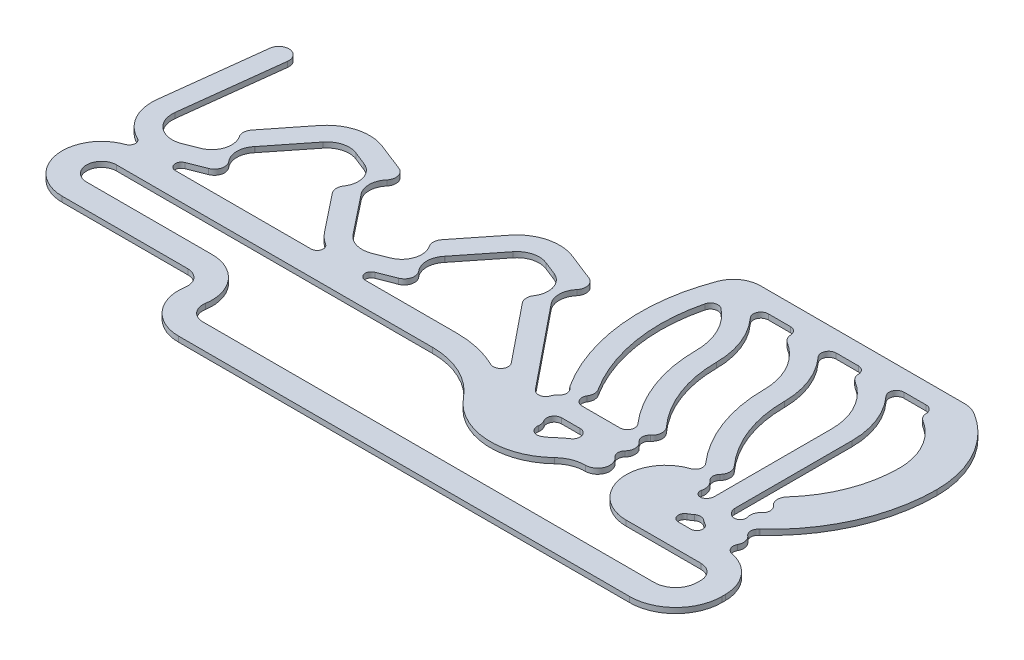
SolidWorks part; units mm, degrees
other "<6021_lower_plate>-<Fillet8>"
ref_plane "X_Y" through (0, 0, 0) normal (0, 0, 1) x (1, 0, 0)
ref_plane "Z_X" through (0, 0, 0) normal (0, 1, 0) x (1, 0, 0)
ref_plane "Y_Z" through (0, 0, 0) normal (1, 0, 0) x (0, 0, -1)
ref_plane "X_Y-6021_lower_plate" through (0, 0, 0) normal (0, 0, 1) x (1, 0, 0)
ref_plane "Z_X-6021_lower_plate" through (0, 0, 0) normal (0, 1, 0) x (1, 0, 0)
ref_plane "Y_Z-6021_lower_plate" through (0, 0, 0) normal (1, 0, 0) x (0, 0, -1)
ref_plane "X_Y-_6021_master-6021_lower_plate" through (0, 0, 0) normal (0, 0, 1) x (1, 0, 0)
ref_plane "Z_X_peltier-_6021_master-6021_lower_plate" through (0, 0, 0) normal (0, 1, 0) x (1, 0, 0)
ref_plane "Y_Z-_6021_master-6021_lower_plate" through (0, 0, 0) normal (1, 0, 0) x (0, 0, -1)
sketch "zx_sketch-_6021_master-6021_lower_plate" plane through (0, 0, 0) normal (0, 1, 0) x (1, 0, 0)
  line L0 (0, 0) -> (0, 39833.2138) construction
  line L1 (-56.5, 24.66) -> (4, 24.66)
  line L2 (-56.5, 24.66) -> (-56.5, -27)
  line L3 (-56.5, -27) -> (56.5, -27)
  line L4 (56.5, 27) -> (56.5, -27)
  line L5 (0, 0) -> (39833.2138, 0) construction
  line L6 (4, 24.66) -> (4, 27)
  line L11 (4, 27) -> (56.5, 27)
  point P3 (0, -27)
  point P17 (-22.5, 15.66)
  point P18 (22.5, 15.66)
  point P19 (22.5, -15.66)
  point P20 (-22.5, -15.66)
  dimension "D1" = 113
  dimension "D2" = 24.66
  dimension "D3" = 45
  dimension "D4" = 31.32
  dimension "D5" = 27
  dimension "D6" = 2.34
  dimension "D7" = 4
  dimension "D8" = 27
sketch "xy_sketch-_6021_master-6021_lower_plate" plane through (0, 0, 0) normal (0, 0, 1) x (1, 0, 0)
  line L0 (0, 0) -> (0, 5) construction
  line L1 (0, 5) -> (0, 7.3) construction
  dimension "D1" = 5
  dimension "D2" = 2.3
ref_plane "zx_lower_plate-_6021_master-6021_lower_plate" through (0, 5, 0) normal (0, 1, 0) x (1, 0, 0)
ref_plane "zx_sensor-_6021_master-6021_lower_plate" through (0, 7.3, 0) normal (0, 1, 0) x (1, 0, 0)
sketch "zx_sensor_sketch-_6021_master-6021_lower_plate" plane through (0, 7.3, 0) normal (0, 1, 0) x (1, 0, 0)
  line L0 (-42.2, 3.16) -> (-28.2, 8.66) construction
  line L1 (-28.2, 8.66) -> (-14.2, 3.16) construction
  line L2 (-14.2, 3.16) -> (-0.2, 8.66) construction
  line L3 (-42.2, 4.96) -> (-42.2, -0.8) construction
  line L4 (-28.2, 10.46) -> (-28.2, 4.7) construction
  line L5 (-14.2, 4.96) -> (-14.2, -0.8) construction
  line L6 (-0.2, 10.46) -> (-0.2, 4.7) construction
  line L7 (-42.2, 3.16) -> (-42.2, -0.8) construction
  line L8 (-28.2, 8.66) -> (-28.2, 4.7) construction
  line L9 (-14.2, 3.16) -> (-14.2, -0.8) construction
  line L10 (-0.2, 8.66) -> (-0.2, 4.7) construction
  line L11 (-39.215, 3.16) -> (-45.185, 3.16) construction
  line L12 (-39.215, 7.475) -> (-39.215, -1.155) construction
  line L13 (-44.615, 3.16) -> (-39.785, 3.16) construction
  point P8 (-42.2, 2.08)
  point P16 (-42.2, 3.16)
  point P19 (-39.215, 3.16)
  point P22 (-42.2, 3.16)
  dimension "D3" = 14
  dimension "D4" = 1.08
  dimension "D6" = 5.76
  dimension "D7" = 5.97
  dimension "D9" = 8.63
  dimension "D10" = 4.83
  dimension "D11" = 5.5
sketch "zx_valve_sketch-_6021_master-6021_lower_plate" plane through (0, 8.2, 0) normal (0, 1, 0) x (1, 0, 0)
  line L0 (44, -4.25) -> (34, -4.25) construction
  line L1 (34, -4.25) -> (24, -4.25) construction
  line L2 (24, -4.25) -> (14, -4.25) construction
  line L3 (44, -10.5) -> (44, -6.5) construction
  line L4 (44, -6.5) -> (44, -2.5) construction
  line L5 (34, -2.5) -> (34, -6.5) construction
  line L6 (34, -6.5) -> (34, -10.5) construction
  line L7 (24, -2.5) -> (24, -6.5) construction
  line L8 (24, -6.5) -> (24, -10.5) construction
  line L9 (14, -2.5) -> (14, -6.5) construction
  line L10 (14, -6.5) -> (14, -10.5) construction
  line L11 (44, 10.5) -> (44, -19) construction
  line L12 (34, 10.5) -> (34, -19) construction
  line L14 (24, -19) -> (24, 10.5) construction
  line L17 (14, 10.5) -> (14, -19) construction
  point P20 (44, -4.25)
  dimension "D1" = 10
  dimension "D4" = 8
  dimension "D5" = 2.25
  dimension "D6" = 29.5
sketch "zx_manifold_sketch-_6021_master-6021_lower_plate" plane through (0, 5, 0) normal (0, 1, 0) x (1, 0, 0)
  line L0 (-34.0003, 7.58) -> (-22.3997, 7.58) construction
  line L4 (44, 19.5) -> (34, 19.5) construction
  line L5 (34, 19.5) -> (24, 19.5) construction
  line L6 (24, 19.5) -> (14, 19.5) construction
  line L7 (39, 10.5) -> (39, -7.6132)
  line L9 (-48.0003, 2.08) -> (-36.3997, 2.08) construction
  line L11 (-20.0003, 2.08) -> (-8.3997, 2.08) construction
  line L12 (-6.0003, 7.58) -> (5.6003, 7.58) construction
  line L13 (-48.9, -6.72) -> (-2.2958, -6.72)
  line L15 (14, -6.5) -> (24, -6.5)
  line L17 (-14.2, 4.96) -> (-9.7626, 10.5608)
  line L22 (34, -4.7265) -> (44, -4.7265) construction
  line L23 (44, -4.7265) -> (39, -7.6132) construction
  line L24 (-4.2467, 12.0482) -> (-0.2, 10.46)
  line L26 (44, 22) -> (14, 22)
  line L28 (-48.9, -14.72) -> (-30.3969, -14.72)
  line L30 (10.8896, -9.015) -> (7.7791, -11.53) construction
  line L31 (34, -14.5) -> (45, -14.5)
  line L32 (-22.5, -24) -> (44, -24)
  line L35 (-14.2, -0.8) -> (-18.2467, -2.3882)
  line L38 (-52.7667, 2.6469) -> (-51, 17.5)
  line L39 (-28.2, 4.7) -> (-23.7626, -0.9008)
  line L40 (14, 10.5) -> (22.5, 15.66) construction
  line L43 (49, -19) -> (49, -18.5)
  line L45 (-32.2467, 12.0482) -> (-28.2, 10.46)
  line L46 (-37.7626, 10.5608) -> (-42.2, 4.96)
  line L47 (-42.2, -0.8) -> (-46.2467, -2.3882)
  line L48 (-0.2, 4.7) -> (10.8896, -9.015)
  circle A0 centre (34, 19.5) radius 3.85 construction
  circle A1 centre (44, 19.5) radius 3.85 construction
  circle A2 centre (24, 19.5) radius 3.85 construction
  circle A3 centre (14, 19.5) radius 3.85 construction
  arc A4 (34, -10.5) -> (39, -7.6132) centre (34, -4.7265) ccw
  arc A6 (29, 10.5) -> (34, -2.5) centre (48.4, 10.5) ccw
  arc A7 (44, -10.5) -> (39, -7.6132) centre (44, -4.7265) cw
  arc A8 (44, -2.5) -> (49, 10.5) centre (29.6, 10.5) ccw
  arc A11 (45.3208, 21.6226) -> (44, 22) centre (44, 19.5) ccw
  arc A12 (44, -6.5) -> (51.5, 10.5) centre (28.4833, 10.5) ccw
  arc A13 (14, 22) -> (11.6636, 20.3896) centre (14, 19.5) ccw
  arc A15 (34, -14.5) -> (34, -6.5) centre (34, -10.5) cw
  arc A16 (-48.9, -6.72) -> (-48.9, -14.72) centre (-48.9, -10.72) ccw
  arc A17 (44, -24) -> (49, -19) centre (44, -19) ccw
  arc A18 (-22.5, -24) -> (-26.4485, -19.36) centre (-22.5, -20) cw
  arc A19 (-30.3969, -14.72) -> (-26.4485, -19.36) centre (-30.3969, -18.72) cw
  arc A20 (14, -10.5) -> (10.8896, -9.015) centre (14, -6.5) cw
  arc A21 (-4.2467, 12.0482) -> (-9.7626, 10.5608) centre (-6.0003, 7.58) ccw
  circle A22 centre (-51, 17.5) radius 3.85 construction
  arc A23 (-23.7626, -0.9008) -> (-18.2467, -2.3882) centre (-20.0003, 2.08) ccw
  arc A24 (-32.2467, 12.0482) -> (-37.7626, 10.5608) centre (-34.0003, 7.58) ccw
  arc A25 (-46.2467, -2.3882) -> (-52.7667, 2.6469) centre (-48.0003, 2.08) cw
  arc A26 (49, -18.5) -> (45, -14.5) centre (45, -18.5) ccw
  circle A27 centre (-51, 17.5) radius 5.5 construction
  arc A29 (14, 19.5) -> (19, 10.5) centre (8.4, 10.5) cw
  arc A30 (39, 10.5) -> (34, 19.5) centre (28.4, 10.5) ccw
  arc A31 (49, 10.5) -> (44, 19.5) centre (38.4, 10.5) ccw
  arc A32 (29, 10.5) -> (24, 19.5) centre (18.4, 10.5) ccw
  arc A33 (19, 10.5) -> (24, -2.5) centre (38.4, 10.5) ccw
  arc A35 (45.3208, 21.6226) -> (51.5, 10.5) centre (38.4, 10.5) cw
  arc A36 (14, -2.5) -> (11.6636, 20.3896) centre (35.6147, 11.2703) cw
  arc A37 (19.5172, -12.2931) -> (7.7791, -11.53) centre (14, -6.5) cw
  arc A38 (7.7791, -11.53) -> (-2.2958, -6.72) centre (-2.2958, -19.6763) ccw
  arc A39 (24, -10.5) -> (19.5172, -12.2931) centre (24, -17) ccw
  point P73 (0, 0)
  point P75 (0, 0)
  point P107 (0, 0)
  point P121 (-42.2, 2.08)
  dimension "D1" = 30
  dimension "D2" = 7.7
  dimension "D4" = 2.5
  dimension "D5" = 4
  dimension "D6" = 92.9
  dimension "D9" = 4
  dimension "D15" = 4
  dimension "D18" = 4.8
  dimension "D11" = 4
sketch "zx_screws_sketch-_6021_master-6021_lower_plate" plane through (0, 5, 0) normal (0, 1, 0) x (1, 0, 0)
  line L4 (-34.0003, 7.58) -> (-22.3997, 7.58) construction
  line L5 (-20.0003, 2.08) -> (-8.3997, 2.08) construction
  line L6 (-6.0003, 7.58) -> (5.6003, 7.58) construction
  line L7 (-36.3997, 2.08) -> (-48.0003, 2.08) construction
  line L13 (56.5, 27) -> (56.5, -27) construction
  circle A0 centre (52.5, 23) radius 4 construction
  circle A3 centre (52.5, -23) radius 4 construction
  arc A7 (-52.7667, 2.6469) -> (-46.2467, -2.3882) centre (-48.0003, 2.08) ccw construction
  circle A8 centre (-52.5, -23) radius 4 construction
  point P0 (-0.2, -19)
  point P1 (52.5, -23)
  point P2 (52.5, 23)
  point P3 (6.6, 23)
  point P4 (-52.5, -23)
  point P5 (-42.2, 17.5)
ref_plane "yz_sensor-_6021_master-6021_lower_plate" through (-42.2, 0, 0) normal (1, 0, 0) x (0, 0, -1)
ref_plane "zx_valve-_6021_master-6021_lower_plate" through (0, 8.2, 0) normal (0, 1, 0) x (1, 0, 0)
ref_plane "zx_sensor_shelf-_6021_master-6021_lower_plate" through (0, 9.691, 0) normal (0, 1, 0) x (1, 0, 0)
sketch "Sketch7-6021_lower_plate" plane through (0, 5, 0) normal (0, 1, 0) x (1, 0, 0)
  line L6 (-56.5, -27) -> (56.5, -27)
  line L7 (56.5, 27) -> (56.5, -27)
  line L8 (4, 27) -> (56.5, 27)
  line L9 (4, 24.66) -> (4, 27)
  line L10 (-56.5, 24.66) -> (4, 24.66)
  line L11 (-56.5, 24.66) -> (-56.5, -27)
sketch "Sketch33-6021_lower_plate" plane through (0, 5, 0) normal (0, 1, 0) x (1, 0, 0)
  line L6 (-50.6814, 2.3989) -> (-48.9147, 17.252)
  line L7 (-42.9672, 1.1548) -> (-47.0139, -0.4334)
  line L10 (-54.852, 2.895) -> (-53.0853, 17.748)
  line L11 (-41.4328, -2.7548) -> (-45.4795, -4.343)
  line L15 (44, 24.1) -> (14, 24.1)
  line L19 (44, 19.9) -> (14, 19.9)
  line L23 (-40.554, 3.6559) -> (-36.1166, 9.2567)
  line L24 (-33.0139, 10.0934) -> (-28.9672, 8.5052)
  line L27 (-43.846, 6.2641) -> (-39.4086, 11.8649)
  line L28 (-31.4795, 14.003) -> (-27.4328, 12.4148)
  line L33 (-17.4795, -4.343) -> (-13.4328, -2.7548)
  line L34 (-29.846, 3.3959) -> (-25.4086, -2.2049)
  line L37 (-19.0139, -0.4334) -> (-14.9672, 1.1548)
  line L38 (-26.554, 6.0041) -> (-22.1166, 0.4033)
  line L40 (-1.833, 3.3796) -> (9.2566, -10.3354)
  line L43 (-5.0139, 10.0934) -> (-0.9672, 8.5052)
  line L44 (-12.554, 3.6559) -> (-8.1166, 9.2567)
  line L47 (-3.4795, 14.003) -> (0.5672, 12.4148)
  line L48 (-15.846, 6.2641) -> (-11.4086, 11.8649)
  line L50 (1.433, 6.0204) -> (12.5225, -7.6946)
  arc A0 (-53.0853, 17.748) -> (-48.9147, 17.252) centre (-51, 17.5) cw
  arc A1 (-42.9672, 1.1548) -> (-41.4328, -2.7548) centre (-42.2, -0.8) cw
  arc A3 (-50.6814, 2.3989) -> (-47.0139, -0.4334) centre (-48.0003, 2.08) ccw
  arc A5 (-54.852, 2.895) -> (-45.4795, -4.343) centre (-48.0003, 2.08) ccw
  arc A9 (-1.833, 3.3796) -> (1.433, 6.0204) centre (-0.2, 4.7) cw
  arc A14 (-33.0139, 10.0934) -> (-36.1166, 9.2567) centre (-34.0003, 7.58) ccw
  arc A16 (-31.4795, 14.003) -> (-39.4086, 11.8649) centre (-34.0003, 7.58) ccw
  arc A32 (12.2289, -3.6283) -> (15.7711, -1.3717) centre (14, -2.5) ccw
  arc A33 (14, -8.4) -> (14, -12.6) centre (14, -10.5) cw
  arc A34 (42.5843, -4.949) -> (45.4157, -8.051) centre (44, -6.5) ccw
  arc A43 (-25.4086, -2.2049) -> (-17.4795, -4.343) centre (-20.0003, 2.08) ccw
  arc A45 (-22.1166, 0.4033) -> (-19.0139, -0.4334) centre (-20.0003, 2.08) ccw
  arc A48 (-5.0139, 10.0934) -> (-8.1166, 9.2567) centre (-6.0003, 7.58) ccw
  arc A50 (-3.4795, 14.003) -> (-11.4086, 11.8649) centre (-6.0003, 7.58) ccw
  arc A51 (-43.846, 6.2641) -> (-40.554, 3.6559) centre (-42.2, 4.96) ccw
  arc A56 (-28.9672, 8.5052) -> (-27.4328, 12.4148) centre (-28.2, 10.46) ccw
  arc A57 (-29.846, 3.3959) -> (-26.554, 6.0041) centre (-28.2, 4.7) cw
  arc A58 (-15.846, 6.2641) -> (-12.554, 3.6559) centre (-14.2, 4.96) ccw
  arc A59 (-14.9672, 1.1548) -> (-13.4328, -2.7548) centre (-14.2, -0.8) cw
  arc A60 (0.5672, 12.4148) -> (-0.9672, 8.5052) centre (-0.2, 10.46) cw
  arc A67 (9.7011, 21.1368) -> (12.2289, -3.6283) centre (35.6147, 11.2703) ccw
  arc A69 (9.2566, -10.3354) -> (14, -12.6) centre (14, -6.5) ccw
  arc A71 (12.5225, -7.6946) -> (14, -8.4) centre (14, -6.5) ccw
  arc A72 (14, 24.1) -> (9.7011, 21.1368) centre (14, 19.5) ccw
  arc A73 (46.4302, 23.4057) -> (44, 24.1) centre (44, 19.5) ccw
  arc A74 (53.6, 10.5) -> (46.4302, 23.4057) centre (38.4, 10.5) ccw
  arc A75 (45.4157, -8.051) -> (53.6, 10.5) centre (28.4833, 10.5) ccw
  arc A81 (13.6262, 19.6423) -> (15.7711, -1.3717) centre (35.6147, 11.2703) ccw
  arc A82 (14, 19.9) -> (13.6262, 19.6423) centre (14, 19.5) ccw
  arc A83 (44.2113, 19.8396) -> (44, 19.9) centre (44, 19.5) ccw
  arc A84 (49.4, 10.5) -> (44.2113, 19.8396) centre (38.4, 10.5) ccw
  arc A85 (42.5843, -4.949) -> (49.4, 10.5) centre (28.4833, 10.5) ccw
sketch "Sketch34-6021_lower_plate" plane through (0, 5, 0) normal (0, 1, 0) x (1, 0, 0)
  line L5 (41.1, -6.9814) -> (41.1, 10.5)
  line L7 (36.9, -6.9814) -> (36.9, 10.5)
  line L10 (14, -8.6) -> (24, -8.6)
  line L12 (14, -4.4) -> (24, -4.4)
  arc A5 (14, -4.4) -> (14, -8.6) centre (14, -6.5) ccw
  arc A11 (31.1, 10.5) -> (35.5588, -1.0928) centre (48.4, 10.5) ccw
  arc A12 (31.1, 10.5) -> (25.1094, 21.283) centre (18.4, 10.5) ccw
  arc A15 (26.9, 10.5) -> (32.4412, -3.9072) centre (48.4, 10.5) ccw
  arc A16 (26.9, 10.5) -> (22.8906, 17.717) centre (18.4, 10.5) ccw
  arc A18 (41.1, -6.9814) -> (44, -8.4) centre (44, -4.7265) ccw
  arc A19 (41.1, 10.5) -> (35.1094, 21.283) centre (28.4, 10.5) ccw
  arc A22 (39, -10.8086) -> (44, -12.6) centre (44, -4.7265) ccw
  arc A23 (36.9, 10.5) -> (32.8906, 17.717) centre (28.4, 10.5) ccw
  arc A25 (34, -12.6) -> (39, -10.8086) centre (34, -4.7265) ccw
  arc A27 (34, -8.4) -> (36.9, -6.9814) centre (34, -4.7265) ccw
  arc A28 (24, -4.4) -> (24, -8.6) centre (24, -6.5) cw
  arc A29 (35.5588, -1.0928) -> (32.4412, -3.9072) centre (34, -2.5) cw
  arc A30 (34, -8.4) -> (34, -12.6) centre (34, -10.5) ccw
  arc A31 (44, -8.4) -> (44, -12.6) centre (44, -10.5) cw
  arc A32 (22.8906, 17.717) -> (25.1094, 21.283) centre (24, 19.5) cw
  arc A33 (35.1094, 21.283) -> (32.8906, 17.717) centre (34, 19.5) ccw
  arc A36 (42.8906, 17.717) -> (45.1094, 21.283) centre (44, 19.5) cw
  arc A37 (45.5588, -3.9072) -> (42.4412, -1.0928) centre (44, -2.5) cw
  arc A40 (51.1, 10.5) -> (45.1094, 21.283) centre (38.4, 10.5) ccw
  arc A41 (45.5588, -3.9072) -> (51.1, 10.5) centre (29.6, 10.5) ccw
  arc A44 (46.9, 10.5) -> (42.8906, 17.717) centre (38.4, 10.5) ccw
  arc A45 (42.4412, -1.0928) -> (46.9, 10.5) centre (29.6, 10.5) ccw
sketch "Sketch35-6021_lower_plate" plane through (0, 5, 0) normal (0, 1, 0) x (1, 0, 0)
  line L45 (34, -16.9) -> (45, -16.9)
  line L46 (46.6, -18.5) -> (46.6, -19)
  line L47 (44, -21.6) -> (-22.5, -21.6)
  line L48 (-30.3969, -12.32) -> (-48.9, -12.32)
  line L49 (-48.9, -9.12) -> (-2.2958, -9.12)
  line L55 (34, -12.1) -> (45, -12.1)
  line L56 (51.4, -18.5) -> (51.4, -19)
  line L57 (44, -26.4) -> (-22.5, -26.4)
  line L58 (-30.3969, -17.12) -> (-48.9, -17.12)
  line L59 (-48.9, -4.32) -> (-2.2958, -4.32)
  arc A8 (12.8906, 17.717) -> (15.1094, 21.283) centre (14, 19.5) cw
  arc A9 (21.1, 10.5) -> (25.5588, -1.0928) centre (38.4, 10.5) ccw
  arc A11 (21.1, 10.5) -> (15.1094, 21.283) centre (8.4, 10.5) ccw
  arc A13 (22.4412, -3.9072) -> (25.5588, -1.0928) centre (24, -2.5) ccw
  arc A50 (16.9, 10.5) -> (22.4412, -3.9072) centre (38.4, 10.5) ccw
  arc A51 (16.9, 10.5) -> (12.8906, 17.717) centre (8.4, 10.5) ccw
  arc A69 (24, -8.1) -> (24, -12.9) centre (24, -10.5) cw
  arc A70 (34, -4.1) -> (34, -8.9) centre (34, -6.5) cw
  arc A71 (17.8621, -10.5552) -> (24, -8.1) centre (24, -17) cw
  arc A72 (21.1724, -14.031) -> (24, -12.9) centre (24, -17) cw
  arc A87 (34, -4.1) -> (34, -16.9) centre (34, -10.5) ccw
  arc A88 (46.6, -18.5) -> (45, -16.9) centre (45, -18.5) ccw
  arc A89 (44, -21.6) -> (46.6, -19) centre (44, -19) ccw
  arc A90 (-24.0794, -19.744) -> (-22.5, -21.6) centre (-22.5, -20) ccw
  arc A91 (-24.0794, -19.744) -> (-30.3969, -12.32) centre (-30.3969, -18.72) ccw
  arc A92 (-48.9, -9.12) -> (-48.9, -12.32) centre (-48.9, -10.72) ccw
  arc A93 (5.9129, -13.039) -> (-2.2958, -9.12) centre (-2.2958, -19.6763) ccw
  arc A94 (5.9129, -13.039) -> (21.1724, -14.031) centre (14, -6.5) ccw
  arc A119 (34, -8.9) -> (34, -12.1) centre (34, -10.5) ccw
  arc A120 (51.4, -18.5) -> (45, -12.1) centre (45, -18.5) ccw
  arc A121 (44, -26.4) -> (51.4, -19) centre (44, -19) ccw
  arc A122 (-28.8175, -18.976) -> (-22.5, -26.4) centre (-22.5, -20) ccw
  arc A123 (-28.8175, -18.976) -> (-30.3969, -17.12) centre (-30.3969, -18.72) ccw
  arc A124 (-48.9, -4.32) -> (-48.9, -17.12) centre (-48.9, -10.72) ccw
  arc A125 (9.6454, -10.021) -> (-2.2958, -4.32) centre (-2.2958, -19.6763) ccw
  arc A126 (9.6454, -10.021) -> (17.8621, -10.5552) centre (14, -6.5) ccw
  point P8 (22.3624, -8.3387)
  point P10 (0, 0)
sketch "Sketch36-6021_lower_plate" plane through (0, 5, 0) normal (0, 1, 0) x (1, 0, 0)
  line L1 (-42.9672, 1.1548) -> (-45.0438, 0.3399)
  line L3 (-31.0261, 9.3132) -> (-28.9672, 8.5052)
  arc A0 (-43.9508, 3.8004) -> (-45.0438, 0.3399) centre (-45.8963, 2.512) cw
  arc A2 (-40.6034, 3.5958) -> (-40.6034, 0.5642) centre (-38.8294, 2.08) ccw
  arc A5 (-40.6034, 0.5642) -> (-42.9672, 1.1548) centre (-42.2, -0.8) ccw
  arc A6 (-43.9508, 3.8004) -> (-40.6034, 3.5958) centre (-42.2, 4.96) ccw
  arc A9 (-26.6075, 6.0689) -> (-29.9458, 5.8671) centre (-28.2, 4.7) ccw
  arc A10 (-28.9672, 8.5052) -> (-26.6075, 9.0911) centre (-28.2, 10.46) ccw
  arc A11 (-26.6075, 9.0911) -> (-26.6075, 6.0689) centre (-24.8496, 7.58) ccw
  arc A12 (-31.0261, 9.3132) -> (-29.9458, 5.8671) centre (-31.873, 7.1554) cw
  dimension "D1" = 2.4
  dimension "D2" = 2.4
sketch "xz_cover-_6021_master-6021_lower_plate" plane through (0, 0, 0) normal (0, 1, 0) x (1, 0, 0)
  line L1 (-63, -36.79) -> (63, -36.79)
  line L2 (-71.85, -27.94) -> (-71.85, 30.02)
  line L3 (-71.85, 30.02) -> (71.85, 30.02)
  line L4 (71.85, -27.94) -> (71.85, 30.02)
  line L5 (-71.85, -36.79) -> (71.85, 30.02) construction
  line L6 (-71.85, 30.02) -> (71.85, -36.79) construction
  line L7 (0, -1003.385) -> (0, 48996.615) construction
  arc A0 (71.85, -27.94) -> (63, -36.79) centre (63, -27.94) cw
  arc A1 (-63, -36.79) -> (-71.85, -27.94) centre (-63, -27.94) cw
  circle A2 centre (-64.495, 5.21) radius 3.6
  circle A3 centre (64.495, 5.21) radius 3.6
  point P0 (0, -3.385)
  dimension "D4" = 8.85
  dimension "D5" = 42
  dimension "D7" = 7.2
  dimension "D1" = 66.81
  dimension "D2" = 143.7
  dimension "D6" = 128.99
inserted part "6021_lower_plate"
sketch "Sketch25" plane through (0, 4.4, 0) normal (0, 1, 0) x (1, 0, 0)
  line L1 (-52.4895, 17.6772) -> (-54.2562, 2.8241)
  line L7 (-2.2958, -8.52) -> (-48.9, -8.52)
  line L22 (37.5, -6.8028) -> (37.5, 10.5)
  line L26 (40.5, 10.5) -> (40.5, -6.8028)
  line L30 (5.4905, -4.7233) -> (-1.3664, 3.7569)
  line L64 (40.5, 10.5) -> (40.5, -6.8028)
  line L67 (38.0953, -12.7) -> (39.9047, -12.7)
  line L68 (16.1909, -5) -> (21.7675, -5)
  line L73 (37.5, -6.8028) -> (37.5, 10.5)
  line L115 (-2.2958, -8.52) -> (-48.9, -8.52)
  line L141 (41.4019, 20.5) -> (38.1483, 20.5)
  line L161 (38.0953, -12.7) -> (39.9047, -12.7)
  line L167 (31.4019, 20.5) -> (28.1483, 20.5)
  line L171 (31.4019, 20.5) -> (28.1483, 20.5)
  line L179 (-48.9, -12.92) -> (-30.3969, -12.92)
  line L191 (-48.9, -12.92) -> (-30.3969, -12.92)
  line L204 (-22.5, -22.2) -> (44, -22.2)
  line L210 (41.4019, 20.5) -> (38.1483, 20.5)
  line L226 (16.1909, -5) -> (21.7675, -5)
  line L228 (18.9059, -8) -> (16.1909, -8)
  line L230 (18.9059, -8) -> (16.1909, -8)
  line L234 (-41.652, -2.1963) -> (-44.164, -3.1822)
  line L236 (-43.8352, -4.92) -> (-23.8252, -4.92)
  line L238 (-24.9383, -1.8323) -> (-29.3757, 3.7685)
  line L240 (-30.8069, 9.8717) -> (-32.7947, 10.6519)
  line L242 (-36.5869, 9.6293) -> (-41.0243, 4.0285)
  line L244 (-41.652, -2.1963) -> (-44.164, -3.1822)
  line L245 (-43.8352, -4.92) -> (-23.8252, -4.92)
  line L246 (-24.9383, -1.8323) -> (-29.3757, 3.7685)
  line L247 (-30.8069, 9.8717) -> (-32.7947, 10.6519)
  line L248 (-36.5869, 9.6293) -> (-41.0243, 4.0285)
  line L289 (5.4905, -4.7233) -> (-1.3664, 3.7569)
  line L291 (-2.8069, 9.8717) -> (-4.7947, 10.6519)
  line L293 (-2.8069, 9.8717) -> (-4.7947, 10.6519)
  line L295 (-8.5869, 9.6293) -> (-13.0243, 4.0285)
  line L297 (-52.4895, 17.6772) -> (-54.2562, 2.8241)
  line L298 (-51.2772, 2.4698) -> (-49.5105, 17.3228)
  line L299 (-51.2772, 2.4698) -> (-49.5105, 17.3228)
  line L300 (-44.8246, -0.2187) -> (-46.7947, -0.9919)
  line L301 (-44.8246, -0.2187) -> (-46.7947, -0.9919)
  line L302 (-38.9383, 11.4923) -> (-43.3757, 5.8915)
  line L303 (-38.9383, 11.4923) -> (-43.3757, 5.8915)
  line L304 (-27.652, 11.8563) -> (-31.6987, 13.4445)
  line L305 (-27.652, 11.8563) -> (-31.6987, 13.4445)
  line L306 (-22.5869, 0.0307) -> (-27.0243, 5.6315)
  line L307 (-22.5869, 0.0307) -> (-27.0243, 5.6315)
  line L308 (-16.8246, -0.2187) -> (-18.7947, -0.9919)
  line L309 (-16.8246, -0.2187) -> (-18.7947, -0.9919)
  line L310 (-10.9383, 11.4923) -> (-15.3757, 5.8915)
  line L311 (-10.9383, 11.4923) -> (-15.3757, 5.8915)
  line L312 (0.348, 11.8563) -> (-3.6987, 13.4445)
  line L313 (0.348, 11.8563) -> (-3.6987, 13.4445)
  line L314 (10.6785, -6.3682) -> (0.9664, 5.6431)
  line L315 (10.6785, -6.3682) -> (0.9664, 5.6431)
  line L316 (44, 23.5) -> (14, 23.5)
  line L317 (44, 23.5) -> (14, 23.5)
  line L318 (50.8, -19) -> (50.8, -18.5)
  line L319 (50.8, -19) -> (50.8, -18.5)
  line L320 (-22.5, -25.8) -> (44, -25.8)
  line L321 (-22.5, -25.8) -> (44, -25.8)
  line L322 (-48.9, -16.52) -> (-30.3969, -16.52)
  line L323 (-48.9, -16.52) -> (-30.3969, -16.52)
  line L324 (-8.5869, 9.6293) -> (-13.0243, 4.0285)
  line L325 (-13.652, -2.1963) -> (-16.164, -3.1822)
  line L326 (-13.652, -2.1963) -> (-16.164, -3.1822)
  line L327 (-15.8352, -4.92) -> (-2.2958, -4.92)
  line L328 (-15.8352, -4.92) -> (-2.2958, -4.92)
  line L330 (-22.5, -22.2) -> (44, -22.2)
  line L331 (47.2, -19) -> (47.2, -18.5)
  line L332 (47.2, -19) -> (47.2, -18.5)
  line L333 (45, -16.3) -> (34, -16.3)
  line L334 (45, -16.3) -> (34, -16.3)
  line L335 (21.4019, 20.5) -> (18.1483, 20.5)
  line L336 (21.4019, 20.5) -> (18.1483, 20.5)
  arc A5 (39.6568, -10.5609) -> (40.3556, -11.0211) centre (44, -4.7265) ccw
  arc A6 (27.5, 10.5) -> (32.6445, -3.2323) centre (48.4, 10.5) ccw
  arc A7 (45.3238, -11.2053) -> (44.9585, -9.3462) centre (44, -10.5) ccw
  arc A12 (-4.7947, 10.6519) -> (-8.5869, 9.6293) centre (-6.0003, 7.58) ccw
  arc A35 (45.3238, -11.2053) -> (44.9585, -9.3462) centre (44, -10.5) ccw
  arc A64 (37.1098, -7.6577) -> (37.2319, -7.5225) centre (34, -4.7265) ccw
  arc A72 (37.1098, -7.6577) -> (37.2319, -7.5225) centre (34, -4.7265) ccw
  arc A76 (40.7681, -7.5225) -> (41.0911, -7.8571) centre (44, -4.7265) ccw
  arc A84 (40.7681, -7.5225) -> (41.0911, -7.8571) centre (44, -4.7265) ccw
  arc A175 (-1.447, 5.5336) -> (-2.8069, 9.8717) centre (-3.873, 7.1554) ccw
  arc A191 (-1.447, 5.5336) -> (-2.8069, 9.8717) centre (-3.873, 7.1554) ccw
  arc A302 (37.2319, -7.5225) -> (37.5, -6.8028) centre (36.4, -6.8028) ccw
  arc A326 (42.8866, -1.4948) -> (43.0401, -3.6527) centre (44, -2.5) ccw
  arc A374 (37.2319, -7.5225) -> (37.5, -6.8028) centre (36.4, -6.8028) ccw
  arc A415 (-4.7947, 10.6519) -> (-8.5869, 9.6293) centre (-6.0003, 7.58) ccw
  arc A460 (27.5, 10.5) -> (32.6445, -3.2323) centre (48.4, 10.5) ccw
  arc A508 (37.5, 10.5) -> (33.2075, 18.2264) centre (28.4, 10.5) ccw
  arc A512 (37.5, 10.5) -> (33.2075, 18.2264) centre (28.4, 10.5) ccw
  arc A516 (42.8866, -1.4948) -> (43.0401, -3.6527) centre (44, -2.5) ccw
  arc A521 (42.8866, -1.4948) -> (47.5, 10.5) centre (29.6, 10.5) ccw
  arc A532 (42.8866, -1.4948) -> (47.5, 10.5) centre (29.6, 10.5) ccw
  arc A538 (39.6568, -10.5609) -> (40.3556, -11.0211) centre (44, -4.7265) ccw
  arc A548 (39.6568, -10.5609) -> (38.3432, -10.5609) centre (39, -11.4433) ccw
  arc A552 (39.6568, -10.5609) -> (38.3432, -10.5609) centre (39, -11.4433) ccw
  arc A556 (37.6444, -11.0211) -> (38.3432, -10.5609) centre (34, -4.7265) ccw
  arc A561 (37.6444, -11.0211) -> (38.3432, -10.5609) centre (34, -4.7265) ccw
  arc A566 (-54.2562, 2.8241) -> (-50.7411, -3.5926) centre (-48.0003, 2.08) ccw
  arc A574 (27.5, 10.5) -> (23.2075, 18.2264) centre (18.4, 10.5) ccw
  arc A576 (-13.0596, 3.9856) -> (-13.0243, 4.0285) centre (-14.2, 4.96) ccw
  arc A578 (32.5011, 19.4423) -> (33.2075, 18.2264) centre (34, 19.5) ccw
  arc A585 (32.5011, 19.4423) -> (33.2075, 18.2264) centre (34, 19.5) ccw
  arc A588 (-13.0596, 3.9856) -> (-13.0243, 4.0285) centre (-14.2, 4.96) ccw
  arc A592 (-13.0596, 3.9856) -> (-13.0596, 0.1744) centre (-10.8294, 2.08) ccw
  arc A596 (-13.0596, 3.9856) -> (-13.0596, 0.1744) centre (-10.8294, 2.08) ccw
  arc A605 (-13.652, -2.1963) -> (-13.0596, 0.1744) centre (-14.2, -0.8) ccw
  arc A611 (27.5, 10.5) -> (23.2075, 18.2264) centre (18.4, 10.5) ccw
  arc A615 (22.5011, 19.4423) -> (23.2075, 18.2264) centre (24, 19.5) ccw
  arc A619 (22.5011, 19.4423) -> (23.2075, 18.2264) centre (24, 19.5) ccw
  arc A641 (19.502, -10.0245) -> (18.2759, -10.9897) centre (24, -17) ccw
  arc A643 (15.264, -3.3077) -> (15.2651, -1.694) centre (14, -2.5) ccw
  arc A645 (30.5, 10.5) -> (27.336, 18.6583) centre (18.4, 10.5) ccw
  arc A647 (30.5, 10.5) -> (27.336, 18.6583) centre (18.4, 10.5) ccw
  arc A649 (30.5, 10.5) -> (35.1134, -1.4948) centre (48.4, 10.5) ccw
  arc A651 (30.5, 10.5) -> (35.1134, -1.4948) centre (48.4, 10.5) ccw
  arc A653 (47.5, 10.5) -> (43.2075, 18.2264) centre (38.4, 10.5) ccw
  arc A655 (47.5, 10.5) -> (43.2075, 18.2264) centre (38.4, 10.5) ccw
  arc A657 (42.5011, 19.4423) -> (43.2075, 18.2264) centre (44, 19.5) ccw
  arc A659 (42.5011, 19.4423) -> (43.2075, 18.2264) centre (44, 19.5) ccw
  arc A661 (40.5, 10.5) -> (37.336, 18.6583) centre (28.4, 10.5) ccw
  arc A663 (40.5, 10.5) -> (37.336, 18.6583) centre (28.4, 10.5) ccw
  arc A665 (39.9047, -12.7) -> (40.3556, -11.0211) centre (39.9047, -11.8) ccw
  arc A667 (39.9047, -12.7) -> (40.3556, -11.0211) centre (39.9047, -11.8) ccw
  arc A669 (37.6444, -11.0211) -> (38.0953, -12.7) centre (38.0953, -11.8) ccw
  arc A671 (37.6444, -11.0211) -> (38.0953, -12.7) centre (38.0953, -11.8) ccw
  arc A682 (15.264, -3.3077) -> (16.1909, -5) centre (16.1909, -3.9) ccw
  arc A685 (-13.652, -2.1963) -> (-13.0596, 0.1744) centre (-14.2, -0.8) ccw
  arc A687 (-16.164, -3.1822) -> (-15.8352, -4.92) centre (-15.8352, -4.02) ccw
  arc A691 (4.1543, -6.4043) -> (-2.2958, -4.92) centre (-2.2958, -19.6763) ccw
  arc A693 (4.1543, -6.4043) -> (-2.2958, -4.92) centre (-2.2958, -19.6763) ccw
  arc A695 (4.1543, -6.4043) -> (5.4905, -4.7233) centre (4.6351, -5.415) ccw
  arc A697 (4.1543, -6.4043) -> (5.4905, -4.7233) centre (4.6351, -5.415) ccw
  arc A699 (-1.447, 5.5336) -> (-1.3664, 3.7569) centre (-0.2, 4.7) ccw
  arc A701 (-1.447, 5.5336) -> (-1.3664, 3.7569) centre (-0.2, 4.7) ccw
  arc A703 (21.7675, -5) -> (22.5991, -3.18) centre (21.7675, -3.9) ccw
  arc A709 (-54.2562, 2.8241) -> (-50.7411, -3.5926) centre (-48.0003, 2.08) ccw
  arc A710 (-49.5105, 17.3228) -> (-52.4895, 17.6772) centre (-51, 17.5) ccw
  arc A711 (-49.5105, 17.3228) -> (-52.4895, 17.6772) centre (-51, 17.5) ccw
  arc A712 (-51.2772, 2.4698) -> (-46.7947, -0.9919) centre (-48.0003, 2.08) ccw
  arc A713 (-51.2772, 2.4698) -> (-46.7947, -0.9919) centre (-48.0003, 2.08) ccw
  arc A714 (-44.8246, -0.2187) -> (-43.4506, 4.1317) centre (-45.8963, 2.512) ccw
  arc A715 (-44.8246, -0.2187) -> (-43.4506, 4.1317) centre (-45.8963, 2.512) ccw
  arc A716 (-43.3757, 5.8915) -> (-43.4506, 4.1317) centre (-42.2, 4.96) ccw
  arc A717 (-43.3757, 5.8915) -> (-43.4506, 4.1317) centre (-42.2, 4.96) ccw
  arc A718 (-31.6987, 13.4445) -> (-38.9383, 11.4923) centre (-34.0003, 7.58) ccw
  arc A719 (-31.6987, 13.4445) -> (-38.9383, 11.4923) centre (-34.0003, 7.58) ccw
  arc A720 (-27.0625, 9.4822) -> (-27.652, 11.8563) centre (-28.2, 10.46) ccw
  arc A721 (-27.0625, 9.4822) -> (-27.652, 11.8563) centre (-28.2, 10.46) ccw
  arc A722 (-27.0625, 9.4822) -> (-27.0625, 5.6778) centre (-24.8496, 7.58) ccw
  arc A723 (-27.0625, 9.4822) -> (-27.0625, 5.6778) centre (-24.8496, 7.58) ccw
  arc A724 (-27.0243, 5.6315) -> (-27.0625, 5.6778) centre (-28.2, 4.7) ccw
  arc A725 (-27.0243, 5.6315) -> (-27.0625, 5.6778) centre (-28.2, 4.7) ccw
  arc A726 (-22.5869, 0.0307) -> (-18.7947, -0.9919) centre (-20.0003, 2.08) ccw
  arc A727 (-22.5869, 0.0307) -> (-18.7947, -0.9919) centre (-20.0003, 2.08) ccw
  arc A728 (-16.8246, -0.2187) -> (-15.4506, 4.1317) centre (-17.8963, 2.512) ccw
  arc A729 (-16.8246, -0.2187) -> (-15.4506, 4.1317) centre (-17.8963, 2.512) ccw
  arc A730 (-15.3757, 5.8915) -> (-15.4506, 4.1317) centre (-14.2, 4.96) ccw
  arc A731 (-15.3757, 5.8915) -> (-15.4506, 4.1317) centre (-14.2, 4.96) ccw
  arc A732 (-3.6987, 13.4445) -> (-10.9383, 11.4923) centre (-6.0003, 7.58) ccw
  arc A733 (-3.6987, 13.4445) -> (-10.9383, 11.4923) centre (-6.0003, 7.58) ccw
  arc A734 (0.9375, 9.4822) -> (0.348, 11.8563) centre (-0.2, 10.46) ccw
  arc A735 (0.9375, 9.4822) -> (0.348, 11.8563) centre (-0.2, 10.46) ccw
  arc A736 (0.9375, 9.4822) -> (0.9375, 5.6778) centre (3.1504, 7.58) ccw
  arc A737 (0.9375, 9.4822) -> (0.9375, 5.6778) centre (3.1504, 7.58) ccw
  arc A738 (13.0415, -5.3462) -> (12.5772, -6.025) centre (14, -6.5) ccw
  arc A739 (13.0415, -5.3462) -> (12.5772, -6.025) centre (14, -6.5) ccw
  arc A740 (-50.8327, -5.2515) -> (-48.9, -16.52) centre (-48.9, -10.72) ccw
  arc A741 (-50.8327, -5.2515) -> (-48.9, -16.52) centre (-48.9, -10.72) ccw
  arc A742 (-50.8327, -5.2515) -> (-50.7411, -3.5926) centre (-51.1326, -4.4029) ccw
  arc A743 (-50.8327, -5.2515) -> (-50.7411, -3.5926) centre (-51.1326, -4.4029) ccw
  arc A744 (0.9664, 5.6431) -> (0.9375, 5.6778) centre (-0.2, 4.7) ccw
  arc A745 (0.9664, 5.6431) -> (0.9375, 5.6778) centre (-0.2, 4.7) ccw
  arc A746 (10.6785, -6.3682) -> (12.5772, -6.025) centre (11.5338, -5.6766) ccw
  arc A747 (10.6785, -6.3682) -> (12.5772, -6.025) centre (11.5338, -5.6766) ccw
  arc A748 (13.0415, -5.3462) -> (13.0415, -3.6538) centre (12.3387, -4.5) ccw
  arc A749 (13.0415, -5.3462) -> (13.0415, -3.6538) centre (12.3387, -4.5) ccw
  arc A750 (12.7349, -3.306) -> (13.0415, -3.6538) centre (14, -2.5) ccw
  arc A751 (12.7349, -3.306) -> (13.0415, -3.6538) centre (14, -2.5) ccw
  arc A752 (10.2618, 20.9233) -> (12.7349, -3.306) centre (35.6147, 11.2703) ccw
  arc A753 (10.2618, 20.9233) -> (12.7349, -3.306) centre (35.6147, 11.2703) ccw
  arc A754 (14, 23.5) -> (10.2618, 20.9233) centre (14, 19.5) ccw
  arc A755 (14, 23.5) -> (10.2618, 20.9233) centre (14, 19.5) ccw
  arc A756 (46.1132, 22.8962) -> (44, 23.5) centre (44, 19.5) ccw
  arc A757 (46.1132, 22.8962) -> (44, 23.5) centre (44, 19.5) ccw
  arc A758 (53, 10.5) -> (46.1132, 22.8962) centre (38.4, 10.5) ccw
  arc A759 (53, 10.5) -> (46.1132, 22.8962) centre (38.4, 10.5) ccw
  arc A760 (45.0112, -7.6079) -> (53, 10.5) centre (28.4833, 10.5) ccw
  arc A761 (45.0112, -7.6079) -> (53, 10.5) centre (28.4833, 10.5) ccw
  arc A762 (44.9585, -7.6538) -> (45.0112, -7.6079) centre (44, -6.5) ccw
  arc A763 (44.9585, -7.6538) -> (45.0112, -7.6079) centre (44, -6.5) ccw
  arc A764 (44.9585, -7.6538) -> (44.9585, -9.3462) centre (45.6613, -8.5) ccw
  arc A765 (44.9585, -7.6538) -> (44.9585, -9.3462) centre (45.6613, -8.5) ccw
  arc A766 (45.3238, -11.2053) -> (46.0883, -12.803) centre (46.2946, -11.7225) ccw
  arc A767 (45.3238, -11.2053) -> (46.0883, -12.803) centre (46.2946, -11.7225) ccw
  arc A768 (50.8, -18.5) -> (46.0883, -12.803) centre (45, -18.5) ccw
  arc A769 (50.8, -18.5) -> (46.0883, -12.803) centre (45, -18.5) ccw
  arc A770 (44, -25.8) -> (50.8, -19) centre (44, -19) ccw
  arc A771 (44, -25.8) -> (50.8, -19) centre (44, -19) ccw
  arc A772 (-28.2253, -19.072) -> (-22.5, -25.8) centre (-22.5, -20) ccw
  arc A773 (-28.2253, -19.072) -> (-22.5, -25.8) centre (-22.5, -20) ccw
  arc A774 (-28.2253, -19.072) -> (-30.3969, -16.52) centre (-30.3969, -18.72) ccw
  arc A775 (-28.2253, -19.072) -> (-30.3969, -16.52) centre (-30.3969, -18.72) ccw
  arc A780 (35.0859, -3.5349) -> (35.1134, -1.4948) centre (34, -2.5) ccw
  arc A781 (35.0859, -3.5349) -> (35.1134, -1.4948) centre (34, -2.5) ccw
  arc A782 (35.7499, -6.9216) -> (35.1682, -5.1306) centre (34, -6.5) ccw
  arc A783 (35.7499, -6.9216) -> (35.1682, -5.1306) centre (34, -6.5) ccw
  arc A784 (35.7499, -6.9216) -> (37.1098, -7.6577) centre (36.5277, -7.1089) ccw
  arc A785 (35.7499, -6.9216) -> (37.1098, -7.6577) centre (36.5277, -7.1089) ccw
  arc A786 (32.5011, 19.4423) -> (31.4019, 20.5) centre (31.4019, 19.4) ccw
  arc A787 (32.5011, 19.4423) -> (31.4019, 20.5) centre (31.4019, 19.4) ccw
  arc A788 (20.5, 10.5) -> (17.336, 18.6583) centre (8.4, 10.5) ccw
  arc A789 (20.5, 10.5) -> (17.336, 18.6583) centre (8.4, 10.5) ccw
  arc A790 (20.5, 10.5) -> (25.1134, -1.4948) centre (38.4, 10.5) ccw
  arc A791 (20.5, 10.5) -> (25.1134, -1.4948) centre (38.4, 10.5) ccw
  arc A792 (24.9585, -3.6538) -> (25.1134, -1.4948) centre (24, -2.5) ccw
  arc A793 (24.9585, -3.6538) -> (25.1134, -1.4948) centre (24, -2.5) ccw
  arc A794 (24.9585, -3.6538) -> (24.9585, -5.3462) centre (25.6613, -4.5) ccw
  arc A795 (24.9585, -3.6538) -> (24.9585, -5.3462) centre (25.6613, -4.5) ccw
  arc A796 (25.0859, -7.5349) -> (24.9585, -5.3462) centre (24, -6.5) ccw
  arc A797 (25.0859, -7.5349) -> (24.9585, -5.3462) centre (24, -6.5) ccw
  arc A798 (25.0859, -7.5349) -> (25.1682, -9.1306) centre (25.8821, -8.2938) ccw
  arc A799 (25.0859, -7.5349) -> (25.1682, -9.1306) centre (25.8821, -8.2938) ccw
  arc A800 (24, -12.3) -> (25.1682, -9.1306) centre (24, -10.5) ccw
  arc A801 (24, -12.3) -> (25.1682, -9.1306) centre (24, -10.5) ccw
  arc A802 (24, -12.3) -> (20.7586, -13.5966) centre (24, -17) ccw
  arc A804 (24, -12.3) -> (20.7586, -13.5966) centre (24, -17) ccw
  arc A806 (6.3795, -12.6618) -> (20.7586, -13.5966) centre (14, -6.5) ccw
  arc A807 (6.3795, -12.6618) -> (20.7586, -13.5966) centre (14, -6.5) ccw
  arc A808 (6.3795, -12.6618) -> (-2.2958, -8.52) centre (-2.2958, -19.6763) ccw
  arc A809 (6.3795, -12.6618) -> (-2.2958, -8.52) centre (-2.2958, -19.6763) ccw
  arc A810 (-48.9, -8.52) -> (-48.9, -12.92) centre (-48.9, -10.72) ccw
  arc A811 (-48.9, -8.52) -> (-48.9, -12.92) centre (-48.9, -10.72) ccw
  arc A812 (-24.6717, -19.648) -> (-30.3969, -12.92) centre (-30.3969, -18.72) ccw
  arc A813 (-24.6717, -19.648) -> (-30.3969, -12.92) centre (-30.3969, -18.72) ccw
  arc A814 (-24.6717, -19.648) -> (-22.5, -22.2) centre (-22.5, -20) ccw
  arc A815 (-24.6717, -19.648) -> (-22.5, -22.2) centre (-22.5, -20) ccw
  arc A816 (44, -22.2) -> (47.2, -19) centre (44, -19) ccw
  arc A817 (44, -22.2) -> (47.2, -19) centre (44, -19) ccw
  arc A818 (47.2, -18.5) -> (45, -16.3) centre (45, -18.5) ccw
  arc A819 (47.2, -18.5) -> (45, -16.3) centre (45, -18.5) ccw
  arc A820 (32.1636, -4.9984) -> (34, -16.3) centre (34, -10.5) ccw
  arc A821 (32.1636, -4.9984) -> (34, -16.3) centre (34, -10.5) ccw
  arc A822 (32.1636, -4.9984) -> (32.6445, -3.2323) centre (31.8153, -3.955) ccw
  arc A823 (32.1636, -4.9984) -> (32.6445, -3.2323) centre (31.8153, -3.955) ccw
  arc A824 (22.5011, 19.4423) -> (21.4019, 20.5) centre (21.4019, 19.4) ccw
  arc A825 (22.5011, 19.4423) -> (21.4019, 20.5) centre (21.4019, 19.4) ccw
  arc A826 (18.1483, 20.5) -> (17.336, 18.6583) centre (18.1483, 19.4) ccw
  arc A827 (18.1483, 20.5) -> (17.336, 18.6583) centre (18.1483, 19.4) ccw
  arc A828 (28.1483, 20.5) -> (27.336, 18.6583) centre (28.1483, 19.4) ccw
  arc A829 (28.1483, 20.5) -> (27.336, 18.6583) centre (28.1483, 19.4) ccw
  arc A830 (35.0859, -3.5349) -> (35.1682, -5.1306) centre (35.8821, -4.2937) ccw
  arc A831 (35.0859, -3.5349) -> (35.1682, -5.1306) centre (35.8821, -4.2937) ccw
  arc A832 (17.5, 10.5) -> (22.5991, -3.18) centre (38.4, 10.5) ccw
  arc A833 (40.5, -6.8028) -> (40.7681, -7.5225) centre (41.6, -6.8028) ccw
  arc A834 (40.5, -6.8028) -> (40.7681, -7.5225) centre (41.6, -6.8028) ccw
  arc A835 (41.0911, -7.8571) -> (42.5648, -6.9361) centre (41.7037, -7.1978) ccw
  arc A836 (41.0911, -7.8571) -> (42.5648, -6.9361) centre (41.7037, -7.1978) ccw
  arc A837 (42.9888, -5.3921) -> (42.5648, -6.9361) centre (44, -6.5) ccw
  arc A838 (42.9888, -5.3921) -> (42.5648, -6.9361) centre (44, -6.5) ccw
  arc A839 (42.9888, -5.3921) -> (43.0826, -5.306) centre (28.4833, 10.5) ccw
  arc A840 (42.9888, -5.3921) -> (43.0826, -5.306) centre (28.4833, 10.5) ccw
  arc A841 (43.0826, -5.306) -> (43.0401, -3.6527) centre (42.3362, -4.4979) ccw
  arc A842 (43.0826, -5.306) -> (43.0401, -3.6527) centre (42.3362, -4.4979) ccw
  arc A843 (42.5011, 19.4423) -> (41.4019, 20.5) centre (41.4019, 19.4) ccw
  arc A844 (42.5011, 19.4423) -> (41.4019, 20.5) centre (41.4019, 19.4) ccw
  arc A845 (38.1483, 20.5) -> (37.336, 18.6583) centre (38.1483, 19.4) ccw
  arc A846 (38.1483, 20.5) -> (37.336, 18.6583) centre (38.1483, 19.4) ccw
  arc A847 (17.5, 10.5) -> (13.9413, 17.7183) centre (8.4, 10.5) ccw
  arc A848 (13.9413, 17.7183) -> (12.2042, 17.1121) centre (13.2714, 16.8458) ccw
  arc A849 (12.2042, 17.1121) -> (15.2651, -1.694) centre (35.6147, 11.2703) ccw
  arc A850 (-44.164, -3.1822) -> (-43.8352, -4.92) centre (-43.8352, -4.02) ccw
  arc A851 (-23.8252, -4.92) -> (-23.3471, -3.2575) centre (-23.8252, -4.02) ccw
  arc A852 (-24.9383, -1.8323) -> (-23.3471, -3.2575) centre (-20.0003, 2.08) ccw
  arc A853 (-29.447, 5.5336) -> (-29.3757, 3.7685) centre (-28.2, 4.7) ccw
  arc A854 (-29.447, 5.5336) -> (-30.8069, 9.8717) centre (-31.873, 7.1554) ccw
  arc A855 (-32.7947, 10.6519) -> (-36.5869, 9.6293) centre (-34.0003, 7.58) ccw
  arc A856 (-41.0596, 3.9856) -> (-41.0243, 4.0285) centre (-42.2, 4.96) ccw
  arc A857 (-41.0596, 3.9856) -> (-41.0596, 0.1744) centre (-38.8294, 2.08) ccw
  arc A858 (-41.652, -2.1963) -> (-41.0596, 0.1744) centre (-42.2, -0.8) ccw
  arc A860 (-23.8252, -4.92) -> (-23.3471, -3.2575) centre (-23.8252, -4.02) ccw
  arc A861 (-24.9383, -1.8323) -> (-23.3471, -3.2575) centre (-20.0003, 2.08) ccw
  arc A862 (-29.447, 5.5336) -> (-29.3757, 3.7685) centre (-28.2, 4.7) ccw
  arc A863 (-29.447, 5.5336) -> (-30.8069, 9.8717) centre (-31.873, 7.1554) ccw
  arc A864 (-32.7947, 10.6519) -> (-36.5869, 9.6293) centre (-34.0003, 7.58) ccw
  arc A865 (-41.0596, 3.9856) -> (-41.0243, 4.0285) centre (-42.2, 4.96) ccw
  arc A866 (-41.0596, 3.9856) -> (-41.0596, 0.1744) centre (-38.8294, 2.08) ccw
  arc A867 (-41.652, -2.1963) -> (-41.0596, 0.1744) centre (-42.2, -0.8) ccw
  arc A868 (15.264, -3.3077) -> (15.2651, -1.694) centre (14, -2.5) ccw
  arc A869 (15.4816, -10.7344) -> (15.264, -9.6923) centre (14, -10.5) ccw
  arc A870 (19.502, -10.0245) -> (18.2759, -10.9897) centre (24, -17) ccw
  arc A871 (19.502, -10.0245) -> (18.9059, -8) centre (18.9059, -9.1) ccw
  arc A872 (19.502, -10.0245) -> (18.9059, -8) centre (18.9059, -9.1) ccw
  arc A873 (16.1909, -8) -> (15.264, -9.6923) centre (16.1909, -9.1) ccw
  arc A874 (15.4816, -10.7344) -> (15.264, -9.6923) centre (14, -10.5) ccw
  arc A878 (16.1909, -8) -> (15.264, -9.6923) centre (16.1909, -9.1) ccw
  arc A879 (15.264, -3.3077) -> (16.1909, -5) centre (16.1909, -3.9) ccw
  arc A880 (21.7675, -5) -> (22.5991, -3.18) centre (21.7675, -3.9) ccw
  arc A881 (17.5, 10.5) -> (22.5991, -3.18) centre (38.4, 10.5) ccw
  arc A882 (17.5, 10.5) -> (13.9413, 17.7183) centre (8.4, 10.5) ccw
  arc A883 (13.9413, 17.7183) -> (12.2042, 17.1121) centre (13.2714, 16.8458) ccw
  arc A884 (12.2042, 17.1121) -> (15.2651, -1.694) centre (35.6147, 11.2703) ccw
  arc A885 (15.4816, -10.7344) -> (17.122, -11.8566) centre (16.5681, -10.9063) ccw
  arc A886 (15.4816, -10.7344) -> (17.122, -11.8566) centre (16.5681, -10.9063) ccw
  arc A887 (-16.164, -3.1822) -> (-15.8352, -4.92) centre (-15.8352, -4.02) ccw
  arc A888 (-44.164, -3.1822) -> (-43.8352, -4.92) centre (-43.8352, -4.02) ccw
  arc A889 (17.122, -11.8566) -> (18.2759, -10.9897) centre (14, -6.5) ccw
  arc A890 (17.122, -11.8566) -> (18.2759, -10.9897) centre (14, -6.5) ccw
  dimension "D1" = 0.6
  dimension "D2" = 0.6
  dimension "D3" = 0.6
  dimension "D4" = 0.6
  dimension "D6" = 0.6
  dimension "D7" = 0.6
  dimension "D8" = 0.6
  dimension "D9" = 0.6
  dimension "D10" = 0.6
extrude "Boss-Extrude1" add sketch "Sketch25" along normal blind 0.79 separate body contours A775 A773 L321 A771 L319 A769 A767 A35 A765 A763 A761 A759 A757 L317 A755 A753 A751 A749 A739 A747 L315 A745 A737 A735 L313 A733 L311 A731 A729 L309 A727 L307 A725 A723 A721 L305 A719 L303 A717 A715 L301 A713 L299 A711 L297 A709 A743 A741 L323 A884
delete or keep bodies "Body-Delete/Keep 1" type delete bodies bodies 101
sketch "0.1 offset" plane through (0, 0, 0) normal (0, 1, 0) x (1, 0, 0)
  line L26 (21.4019, 20.6) -> (18.1483, 20.6)
  line L27 (45, -16.2) -> (34, -16.2)
  line L28 (-22.5, -25.9) -> (44, -25.9)
  line L32 (50.9, -19) -> (50.9, -18.5)
  line L33 (44, 23.6) -> (14, 23.6)
  line L34 (10.7562, -6.3054) -> (1.0442, 5.706)
  line L35 (0.3845, 11.9494) -> (-3.6621, 13.5376)
  line L36 (-11.0167, 11.5544) -> (-15.4541, 5.9536)
  line L37 (-16.8611, -0.1256) -> (-18.8312, -0.8988)
  line L38 (-22.5085, 0.0928) -> (-26.9459, 5.6936)
  line L39 (-27.6155, 11.9494) -> (-31.6621, 13.5376)
  line L40 (-39.0167, 11.5544) -> (-43.4541, 5.9536)
  line L41 (-44.8611, -0.1256) -> (-46.8312, -0.8988)
  line L42 (-51.1779, 2.458) -> (-49.4112, 17.311)
  line L43 (-52.5888, 17.689) -> (-54.3555, 2.8359)
  line L44 (-48.9, -16.62) -> (-30.3969, -16.62)
  line L45 (-22.5, -25.9) -> (44, -25.9)
  line L46 (50.9, -19) -> (50.9, -18.5)
  line L47 (44, 23.6) -> (14, 23.6)
  line L64 (10.7562, -6.3054) -> (1.0442, 5.706)
  line L65 (0.3845, 11.9494) -> (-3.6621, 13.5376)
  line L66 (-11.0167, 11.5544) -> (-15.4541, 5.9536)
  line L67 (-16.8611, -0.1256) -> (-18.8312, -0.8988)
  line L68 (-22.5085, 0.0928) -> (-26.9459, 5.6936)
  line L69 (-27.6155, 11.9494) -> (-31.6621, 13.5376)
  line L70 (-39.0167, 11.5544) -> (-43.4541, 5.9536)
  line L71 (-44.8611, -0.1256) -> (-46.8312, -0.8988)
  line L72 (-51.1779, 2.458) -> (-49.4112, 17.311)
  line L73 (-52.5888, 17.689) -> (-54.3555, 2.8359)
  line L74 (-48.9, -16.62) -> (-30.3969, -16.62)
  line L77 (47.3, -19) -> (47.3, -18.5)
  line L78 (-22.5, -22.3) -> (44, -22.3)
  line L79 (-48.9, -13.02) -> (-30.3969, -13.02)
  line L80 (-2.2958, -8.42) -> (-48.9, -8.42)
  line L81 (21.4019, 20.6) -> (18.1483, 20.6)
  line L82 (45, -16.2) -> (34, -16.2)
  line L83 (47.3, -19) -> (47.3, -18.5)
  line L84 (-22.5, -22.3) -> (44, -22.3)
  line L85 (-48.9, -13.02) -> (-30.3969, -13.02)
  line L86 (-2.2958, -8.42) -> (-48.9, -8.42)
  line L91 (-41.6885, -2.1032) -> (-44.2006, -3.0891)
  line L92 (-36.6653, 9.6914) -> (-41.1027, 4.0906)
  line L93 (-30.7703, 9.9648) -> (-32.7582, 10.745)
  line L94 (-24.8599, -1.7702) -> (-29.2973, 3.8306)
  line L95 (-43.8352, -5.02) -> (-23.8252, -5.02)
  line L96 (-41.6885, -2.1032) -> (-44.2006, -3.0891)
  line L97 (-36.6653, 9.6914) -> (-41.1027, 4.0906)
  line L98 (-30.7703, 9.9648) -> (-32.7582, 10.745)
  line L99 (-24.8599, -1.7702) -> (-29.2973, 3.8306)
  line L100 (-43.8352, -5.02) -> (-23.8252, -5.02)
  line L103 (18.9059, -7.9) -> (16.1909, -7.9)
  line L104 (18.9059, -7.9) -> (16.1909, -7.9)
  line L106 (5.5682, -4.6605) -> (-1.2886, 3.8197)
  line L107 (-15.8352, -5.02) -> (-2.2958, -5.02)
  line L108 (-13.6885, -2.1032) -> (-16.2006, -3.0891)
  line L109 (-8.6653, 9.6914) -> (-13.1027, 4.0906)
  line L110 (-2.7703, 9.9648) -> (-4.7582, 10.745)
  line L111 (5.5682, -4.6605) -> (-1.2886, 3.8197)
  line L112 (-15.8352, -5.02) -> (-2.2958, -5.02)
  line L113 (-13.6885, -2.1032) -> (-16.2006, -3.0891)
  line L114 (-8.6653, 9.6914) -> (-13.1027, 4.0906)
  line L115 (-2.7703, 9.9648) -> (-4.7582, 10.745)
  line L116 (16.1909, -5.1) -> (21.7675, -5.1)
  line L117 (16.1909, -5.1) -> (21.7675, -5.1)
  line L119 (38.0953, -12.8) -> (39.9047, -12.8)
  line L120 (38.0953, -12.8) -> (39.9047, -12.8)
  line L124 (31.4019, 20.6) -> (28.1483, 20.6)
  line L125 (37.6, -6.8028) -> (37.6, 10.5)
  line L126 (31.4019, 20.6) -> (28.1483, 20.6)
  line L127 (37.6, -6.8028) -> (37.6, 10.5)
  line L130 (41.4019, 20.6) -> (38.1483, 20.6)
  line L131 (40.4, 10.5) -> (40.4, -6.8028)
  line L132 (41.4019, 20.6) -> (38.1483, 20.6)
  line L133 (40.4, 10.5) -> (40.4, -6.8028)
  arc A70 (-28.324, -19.056) -> (-30.3969, -16.62) centre (-30.3969, -18.72) ccw
  arc A71 (-28.324, -19.056) -> (-22.5, -25.9) centre (-22.5, -20) ccw
  arc A72 (44, -25.9) -> (50.9, -19) centre (44, -19) ccw
  arc A73 (50.9, -18.5) -> (46.107, -12.7048) centre (45, -18.5) ccw
  arc A74 (45.4121, -11.2523) -> (46.107, -12.7048) centre (46.2946, -11.7225) ccw
  arc A75 (45.4121, -11.2523) -> (45.0224, -9.2692) centre (44, -10.5) ccw
  arc A76 (45.0224, -7.7308) -> (45.0224, -9.2692) centre (45.6613, -8.5) ccw
  arc A77 (45.0224, -7.7308) -> (45.0786, -7.6818) centre (44, -6.5) ccw
  arc A78 (45.0786, -7.6818) -> (53.1, 10.5) centre (28.4833, 10.5) ccw
  arc A79 (53.1, 10.5) -> (46.166, 22.9811) centre (38.4, 10.5) ccw
  arc A80 (46.166, 22.9811) -> (44, 23.6) centre (44, 19.5) ccw
  arc A81 (14, 23.6) -> (10.1683, 20.9589) centre (14, 19.5) ccw
  arc A82 (10.1683, 20.9589) -> (12.6506, -3.3597) centre (35.6147, 11.2703) ccw
  arc A83 (12.6506, -3.3597) -> (12.9776, -3.7308) centre (14, -2.5) ccw
  arc A84 (12.9776, -5.2692) -> (12.9776, -3.7308) centre (12.3387, -4.5) ccw
  arc A85 (12.9776, -5.2692) -> (12.4824, -5.9933) centre (14, -6.5) ccw
  arc A86 (10.7562, -6.3054) -> (12.4824, -5.9933) centre (11.5338, -5.6766) ccw
  arc A87 (1.0442, 5.706) -> (1.0133, 5.743) centre (-0.2, 4.7) ccw
  arc A88 (1.0133, 9.417) -> (1.0133, 5.743) centre (3.1504, 7.58) ccw
  arc A89 (1.0133, 9.417) -> (0.3845, 11.9494) centre (-0.2, 10.46) ccw
  arc A90 (-3.6621, 13.5376) -> (-11.0167, 11.5544) centre (-6.0003, 7.58) ccw
  arc A91 (-15.4541, 5.9536) -> (-15.534, 4.0765) centre (-14.2, 4.96) ccw
  arc A92 (-16.8611, -0.1256) -> (-15.534, 4.0765) centre (-17.8963, 2.512) ccw
  arc A93 (-22.5085, 0.0928) -> (-18.8312, -0.8988) centre (-20.0003, 2.08) ccw
  arc A94 (-26.9459, 5.6936) -> (-26.9867, 5.743) centre (-28.2, 4.7) ccw
  arc A95 (-26.9867, 9.417) -> (-26.9867, 5.743) centre (-24.8496, 7.58) ccw
  arc A96 (-26.9867, 9.417) -> (-27.6155, 11.9494) centre (-28.2, 10.46) ccw
  arc A97 (-31.6621, 13.5376) -> (-39.0167, 11.5544) centre (-34.0003, 7.58) ccw
  arc A98 (-43.4541, 5.9536) -> (-43.534, 4.0765) centre (-42.2, 4.96) ccw
  arc A99 (-44.8611, -0.1256) -> (-43.534, 4.0765) centre (-45.8963, 2.512) ccw
  arc A100 (-51.1779, 2.458) -> (-46.8312, -0.8988) centre (-48.0003, 2.08) ccw
  arc A101 (-49.4112, 17.311) -> (-52.5888, 17.689) centre (-51, 17.5) ccw
  arc A136 (-54.3555, 2.8359) -> (-50.7846, -3.6826) centre (-48.0003, 2.08) ccw
  arc A137 (-50.8661, -5.1572) -> (-50.7846, -3.6826) centre (-51.1326, -4.4029) ccw
  arc A138 (-50.8661, -5.1572) -> (-48.9, -16.62) centre (-48.9, -10.72) ccw
  arc A139 (-28.324, -19.056) -> (-30.3969, -16.62) centre (-30.3969, -18.72) ccw
  arc A140 (-28.324, -19.056) -> (-22.5, -25.9) centre (-22.5, -20) ccw
  arc A141 (44, -25.9) -> (50.9, -19) centre (44, -19) ccw
  arc A142 (50.9, -18.5) -> (46.107, -12.7048) centre (45, -18.5) ccw
  arc A143 (45.4121, -11.2523) -> (46.107, -12.7048) centre (46.2946, -11.7225) ccw
  arc A144 (45.4121, -11.2523) -> (45.0224, -9.2692) centre (44, -10.5) ccw
  arc A145 (45.0224, -7.7308) -> (45.0224, -9.2692) centre (45.6613, -8.5) ccw
  arc A146 (45.0224, -7.7308) -> (45.0786, -7.6818) centre (44, -6.5) ccw
  arc A147 (45.0786, -7.6818) -> (53.1, 10.5) centre (28.4833, 10.5) ccw
  arc A148 (53.1, 10.5) -> (46.166, 22.9811) centre (38.4, 10.5) ccw
  arc A149 (46.166, 22.9811) -> (44, 23.6) centre (44, 19.5) ccw
  arc A150 (14, 23.6) -> (10.1683, 20.9589) centre (14, 19.5) ccw
  arc A151 (10.1683, 20.9589) -> (12.6506, -3.3597) centre (35.6147, 11.2703) ccw
  arc A152 (12.6506, -3.3597) -> (12.9776, -3.7308) centre (14, -2.5) ccw
  arc A153 (12.9776, -5.2692) -> (12.9776, -3.7308) centre (12.3387, -4.5) ccw
  arc A154 (12.9776, -5.2692) -> (12.4824, -5.9933) centre (14, -6.5) ccw
  arc A155 (10.7562, -6.3054) -> (12.4824, -5.9933) centre (11.5338, -5.6766) ccw
  arc A156 (1.0442, 5.706) -> (1.0133, 5.743) centre (-0.2, 4.7) ccw
  arc A157 (1.0133, 9.417) -> (1.0133, 5.743) centre (3.1504, 7.58) ccw
  arc A158 (1.0133, 9.417) -> (0.3845, 11.9494) centre (-0.2, 10.46) ccw
  arc A159 (-3.6621, 13.5376) -> (-11.0167, 11.5544) centre (-6.0003, 7.58) ccw
  arc A160 (-15.4541, 5.9536) -> (-15.534, 4.0765) centre (-14.2, 4.96) ccw
  arc A161 (-16.8611, -0.1256) -> (-15.534, 4.0765) centre (-17.8963, 2.512) ccw
  arc A162 (-22.5085, 0.0928) -> (-18.8312, -0.8988) centre (-20.0003, 2.08) ccw
  arc A163 (-26.9459, 5.6936) -> (-26.9867, 5.743) centre (-28.2, 4.7) ccw
  arc A164 (-26.9867, 9.417) -> (-26.9867, 5.743) centre (-24.8496, 7.58) ccw
  arc A165 (-26.9867, 9.417) -> (-27.6155, 11.9494) centre (-28.2, 10.46) ccw
  arc A166 (-31.6621, 13.5376) -> (-39.0167, 11.5544) centre (-34.0003, 7.58) ccw
  arc A167 (-43.4541, 5.9536) -> (-43.534, 4.0765) centre (-42.2, 4.96) ccw
  arc A168 (-44.8611, -0.1256) -> (-43.534, 4.0765) centre (-45.8963, 2.512) ccw
  arc A169 (-51.1779, 2.458) -> (-46.8312, -0.8988) centre (-48.0003, 2.08) ccw
  arc A170 (-49.4112, 17.311) -> (-52.5888, 17.689) centre (-51, 17.5) ccw
  arc A171 (-54.3555, 2.8359) -> (-50.7846, -3.6826) centre (-48.0003, 2.08) ccw
  arc A172 (-50.8661, -5.1572) -> (-50.7846, -3.6826) centre (-51.1326, -4.4029) ccw
  arc A173 (-50.8661, -5.1572) -> (-48.9, -16.62) centre (-48.9, -10.72) ccw
  arc A179 (-41.6885, -2.1032) -> (-41.1356, 0.1095) centre (-42.2, -0.8) ccw
  arc A180 (-41.1356, 4.0505) -> (-41.1356, 0.1095) centre (-38.8294, 2.08) ccw
  arc A181 (-41.1356, 4.0505) -> (-41.1027, 4.0906) centre (-42.2, 4.96) ccw
  arc A182 (-32.7582, 10.745) -> (-36.6653, 9.6914) centre (-34.0003, 7.58) ccw
  arc A183 (18.1483, 20.6) -> (17.2621, 18.5909) centre (18.1483, 19.4) ccw
  arc A184 (22.601, 19.4462) -> (21.4019, 20.6) centre (21.4019, 19.4) ccw
  arc A185 (22.601, 19.4462) -> (23.2604, 18.3113) centre (24, 19.5) ccw
  arc A186 (27.6, 10.5) -> (23.2604, 18.3113) centre (18.4, 10.5) ccw
  arc A187 (27.6, 10.5) -> (32.7199, -3.1665) centre (48.4, 10.5) ccw
  arc A188 (32.1952, -5.0933) -> (32.7199, -3.1665) centre (31.8153, -3.955) ccw
  arc A189 (32.1952, -5.0933) -> (34, -16.2) centre (34, -10.5) ccw
  arc A190 (47.3, -18.5) -> (45, -16.2) centre (45, -18.5) ccw
  arc A191 (44, -22.3) -> (47.3, -19) centre (44, -19) ccw
  arc A192 (-24.7704, -19.632) -> (-22.5, -22.3) centre (-22.5, -20) ccw
  arc A193 (-24.7704, -19.632) -> (-30.3969, -13.02) centre (-30.3969, -18.72) ccw
  arc A194 (-48.9, -8.42) -> (-48.9, -13.02) centre (-48.9, -10.72) ccw
  arc A195 (6.4572, -12.5989) -> (-2.2958, -8.42) centre (-2.2958, -19.6763) ccw
  arc A208 (6.4572, -12.5989) -> (20.6897, -13.5241) centre (14, -6.5) ccw
  arc A209 (24, -12.2) -> (20.6897, -13.5241) centre (24, -17) ccw
  arc A210 (24, -12.2) -> (25.1033, -9.2067) centre (24, -10.5) ccw
  arc A211 (25.0135, -7.4659) -> (25.1033, -9.2067) centre (25.8821, -8.2938) ccw
  arc A212 (25.0135, -7.4659) -> (24.8946, -5.4231) centre (24, -6.5) ccw
  arc A213 (24.8946, -3.5769) -> (24.8946, -5.4231) centre (25.6613, -4.5) ccw
  arc A214 (24.8946, -3.5769) -> (25.0392, -1.5619) centre (24, -2.5) ccw
  arc A215 (20.4, 10.5) -> (25.0392, -1.5619) centre (38.4, 10.5) ccw
  arc A216 (20.4, 10.5) -> (17.2621, 18.5909) centre (8.4, 10.5) ccw
  arc A217 (18.1483, 20.6) -> (17.2621, 18.5909) centre (18.1483, 19.4) ccw
  arc A218 (22.601, 19.4462) -> (21.4019, 20.6) centre (21.4019, 19.4) ccw
  arc A219 (22.601, 19.4462) -> (23.2604, 18.3113) centre (24, 19.5) ccw
  arc A220 (27.6, 10.5) -> (23.2604, 18.3113) centre (18.4, 10.5) ccw
  arc A221 (27.6, 10.5) -> (32.7199, -3.1665) centre (48.4, 10.5) ccw
  arc A222 (32.1952, -5.0933) -> (32.7199, -3.1665) centre (31.8153, -3.955) ccw
  arc A223 (32.1952, -5.0933) -> (34, -16.2) centre (34, -10.5) ccw
  arc A224 (47.3, -18.5) -> (45, -16.2) centre (45, -18.5) ccw
  arc A225 (44, -22.3) -> (47.3, -19) centre (44, -19) ccw
  arc A226 (-24.7704, -19.632) -> (-22.5, -22.3) centre (-22.5, -20) ccw
  arc A227 (-24.7704, -19.632) -> (-30.3969, -13.02) centre (-30.3969, -18.72) ccw
  arc A228 (-48.9, -8.42) -> (-48.9, -13.02) centre (-48.9, -10.72) ccw
  arc A229 (6.4572, -12.5989) -> (-2.2958, -8.42) centre (-2.2958, -19.6763) ccw
  arc A230 (6.4572, -12.5989) -> (20.6897, -13.5241) centre (14, -6.5) ccw
  arc A232 (24, -12.2) -> (25.1033, -9.2067) centre (24, -10.5) ccw
  arc A233 (25.0135, -7.4659) -> (25.1033, -9.2067) centre (25.8821, -8.2938) ccw
  arc A234 (25.0135, -7.4659) -> (24.8946, -5.4231) centre (24, -6.5) ccw
  arc A235 (24.8946, -3.5769) -> (24.8946, -5.4231) centre (25.6613, -4.5) ccw
  arc A236 (24.8946, -3.5769) -> (25.0392, -1.5619) centre (24, -2.5) ccw
  arc A237 (20.4, 10.5) -> (25.0392, -1.5619) centre (38.4, 10.5) ccw
  arc A238 (20.4, 10.5) -> (17.2621, 18.5909) centre (8.4, 10.5) ccw
  arc A239 (-29.3639, 5.4781) -> (-30.7703, 9.9648) centre (-31.873, 7.1554) ccw
  arc A240 (-29.3639, 5.4781) -> (-29.2973, 3.8306) centre (-28.2, 4.7) ccw
  arc A241 (-24.8599, -1.7702) -> (-23.294, -3.1728) centre (-20.0003, 2.08) ccw
  arc A242 (-23.8252, -5.02) -> (-23.294, -3.1728) centre (-23.8252, -4.02) ccw
  arc A243 (-44.2006, -3.0891) -> (-43.8352, -5.02) centre (-43.8352, -4.02) ccw
  arc A244 (-41.6885, -2.1032) -> (-41.1356, 0.1095) centre (-42.2, -0.8) ccw
  arc A245 (-41.1356, 4.0505) -> (-41.1356, 0.1095) centre (-38.8294, 2.08) ccw
  arc A246 (-41.1356, 4.0505) -> (-41.1027, 4.0906) centre (-42.2, 4.96) ccw
  arc A247 (-32.7582, 10.745) -> (-36.6653, 9.6914) centre (-34.0003, 7.58) ccw
  arc A248 (-29.3639, 5.4781) -> (-30.7703, 9.9648) centre (-31.873, 7.1554) ccw
  arc A249 (-29.3639, 5.4781) -> (-29.2973, 3.8306) centre (-28.2, 4.7) ccw
  arc A250 (-24.8599, -1.7702) -> (-23.294, -3.1728) centre (-20.0003, 2.08) ccw
  arc A251 (-23.8252, -5.02) -> (-23.294, -3.1728) centre (-23.8252, -4.02) ccw
  arc A262 (-1.3639, 5.4781) -> (-2.7703, 9.9648) centre (-3.873, 7.1554) ccw
  arc A263 (-1.3639, 5.4781) -> (-1.2886, 3.8197) centre (-0.2, 4.7) ccw
  arc A264 (4.1106, -6.4943) -> (5.5682, -4.6605) centre (4.6351, -5.415) ccw
  arc A265 (4.1106, -6.4943) -> (-2.2958, -5.02) centre (-2.2958, -19.6763) ccw
  arc A266 (-16.2006, -3.0891) -> (-15.8352, -5.02) centre (-15.8352, -4.02) ccw
  arc A267 (-13.6885, -2.1032) -> (-13.1356, 0.1095) centre (-14.2, -0.8) ccw
  arc A268 (-13.1356, 4.0505) -> (-13.1356, 0.1095) centre (-10.8294, 2.08) ccw
  arc A269 (-13.1356, 4.0505) -> (-13.1027, 4.0906) centre (-14.2, 4.96) ccw
  arc A270 (-4.7582, 10.745) -> (-8.6653, 9.6914) centre (-6.0003, 7.58) ccw
  arc A271 (-1.3639, 5.4781) -> (-2.7703, 9.9648) centre (-3.873, 7.1554) ccw
  arc A272 (-1.3639, 5.4781) -> (-1.2886, 3.8197) centre (-0.2, 4.7) ccw
  arc A273 (4.1106, -6.4943) -> (5.5682, -4.6605) centre (4.6351, -5.415) ccw
  arc A274 (4.1106, -6.4943) -> (-2.2958, -5.02) centre (-2.2958, -19.6763) ccw
  arc A276 (-13.6885, -2.1032) -> (-13.1356, 0.1095) centre (-14.2, -0.8) ccw
  arc A277 (-13.1356, 4.0505) -> (-13.1356, 0.1095) centre (-10.8294, 2.08) ccw
  arc A278 (-13.1356, 4.0505) -> (-13.1027, 4.0906) centre (-14.2, 4.96) ccw
  arc A279 (-4.7582, 10.745) -> (-8.6653, 9.6914) centre (-6.0003, 7.58) ccw
  arc A281 (16.1909, -7.9) -> (15.1797, -9.7462) centre (16.1909, -9.1) ccw
  arc A282 (17.1723, -11.943) -> (18.3448, -11.0621) centre (14, -6.5) ccw
  arc A283 (17.1723, -11.943) -> (18.3448, -11.0621) centre (14, -6.5) ccw
  arc A284 (15.3828, -10.7188) -> (17.1723, -11.943) centre (16.5681, -10.9063) ccw
  arc A285 (15.3828, -10.7188) -> (15.1797, -9.7462) centre (14, -10.5) ccw
  arc A286 (16.1909, -7.9) -> (15.1797, -9.7462) centre (16.1909, -9.1) ccw
  arc A290 (15.3828, -10.7188) -> (15.1797, -9.7462) centre (14, -10.5) ccw
  arc A311 (12.1071, 17.1363) -> (15.1807, -1.7478) centre (35.6147, 11.2703) ccw
  arc A312 (14.0021, 17.7977) -> (12.1071, 17.1363) centre (13.2714, 16.8458) ccw
  arc A313 (17.6, 10.5) -> (14.0021, 17.7977) centre (8.4, 10.5) ccw
  arc A314 (17.6, 10.5) -> (22.6747, -3.1145) centre (38.4, 10.5) ccw
  arc A315 (21.7675, -5.1) -> (22.6747, -3.1145) centre (21.7675, -3.9) ccw
  arc A316 (15.1797, -3.2538) -> (16.1909, -5.1) centre (16.1909, -3.9) ccw
  arc A317 (15.1797, -3.2538) -> (15.1807, -1.7478) centre (14, -2.5) ccw
  arc A318 (12.1071, 17.1363) -> (15.1807, -1.7478) centre (35.6147, 11.2703) ccw
  arc A319 (14.0021, 17.7977) -> (12.1071, 17.1363) centre (13.2714, 16.8458) ccw
  arc A320 (17.6, 10.5) -> (14.0021, 17.7977) centre (8.4, 10.5) ccw
  arc A321 (17.6, 10.5) -> (22.6747, -3.1145) centre (38.4, 10.5) ccw
  arc A322 (21.7675, -5.1) -> (22.6747, -3.1145) centre (21.7675, -3.9) ccw
  arc A323 (15.1797, -3.2538) -> (16.1909, -5.1) centre (16.1909, -3.9) ccw
  arc A324 (15.1797, -3.2538) -> (15.1807, -1.7478) centre (14, -2.5) ccw
  arc A328 (37.5943, -10.9346) -> (38.0953, -12.8) centre (38.0953, -11.8) ccw
  arc A329 (37.5943, -10.9346) -> (38.2835, -10.4807) centre (34, -4.7265) ccw
  arc A330 (39.7165, -10.4807) -> (38.2835, -10.4807) centre (39, -11.4433) ccw
  arc A331 (39.7165, -10.4807) -> (40.4057, -10.9346) centre (44, -4.7265) ccw
  arc A332 (39.9047, -12.8) -> (40.4057, -10.9346) centre (39.9047, -11.8) ccw
  arc A333 (37.5943, -10.9346) -> (38.0953, -12.8) centre (38.0953, -11.8) ccw
  arc A334 (37.5943, -10.9346) -> (38.2835, -10.4807) centre (34, -4.7265) ccw
  arc A335 (39.7165, -10.4807) -> (38.2835, -10.4807) centre (39, -11.4433) ccw
  arc A336 (39.7165, -10.4807) -> (40.4057, -10.9346) centre (44, -4.7265) ccw
  arc A337 (39.9047, -12.8) -> (40.4057, -10.9346) centre (39.9047, -11.8) ccw
  arc A357 (35.0135, -3.4659) -> (35.1033, -5.2067) centre (35.8821, -4.2937) ccw
  arc A358 (35.0135, -3.4659) -> (35.0392, -1.5619) centre (34, -2.5) ccw
  arc A359 (30.4, 10.5) -> (35.0392, -1.5619) centre (48.4, 10.5) ccw
  arc A360 (30.4, 10.5) -> (27.2621, 18.5909) centre (18.4, 10.5) ccw
  arc A361 (28.1483, 20.6) -> (27.2621, 18.5909) centre (28.1483, 19.4) ccw
  arc A362 (32.601, 19.4462) -> (31.4019, 20.6) centre (31.4019, 19.4) ccw
  arc A363 (32.601, 19.4462) -> (33.2604, 18.3113) centre (34, 19.5) ccw
  arc A364 (37.6, 10.5) -> (33.2604, 18.3113) centre (28.4, 10.5) ccw
  arc A365 (37.3075, -7.5879) -> (37.6, -6.8028) centre (36.4, -6.8028) ccw
  arc A366 (37.1826, -7.7262) -> (37.3075, -7.5879) centre (34, -4.7265) ccw
  arc A367 (35.6527, -6.8982) -> (37.1826, -7.7262) centre (36.5277, -7.1089) ccw
  arc A368 (35.6527, -6.8982) -> (35.1033, -5.2067) centre (34, -6.5) ccw
  arc A369 (35.0135, -3.4659) -> (35.1033, -5.2067) centre (35.8821, -4.2937) ccw
  arc A370 (35.0135, -3.4659) -> (35.0392, -1.5619) centre (34, -2.5) ccw
  arc A371 (30.4, 10.5) -> (35.0392, -1.5619) centre (48.4, 10.5) ccw
  arc A372 (30.4, 10.5) -> (27.2621, 18.5909) centre (18.4, 10.5) ccw
  arc A373 (28.1483, 20.6) -> (27.2621, 18.5909) centre (28.1483, 19.4) ccw
  arc A374 (32.601, 19.4462) -> (31.4019, 20.6) centre (31.4019, 19.4) ccw
  arc A375 (32.601, 19.4462) -> (33.2604, 18.3113) centre (34, 19.5) ccw
  arc A376 (37.6, 10.5) -> (33.2604, 18.3113) centre (28.4, 10.5) ccw
  arc A377 (37.3075, -7.5879) -> (37.6, -6.8028) centre (36.4, -6.8028) ccw
  arc A378 (37.1826, -7.7262) -> (37.3075, -7.5879) centre (34, -4.7265) ccw
  arc A379 (35.6527, -6.8982) -> (37.1826, -7.7262) centre (36.5277, -7.1089) ccw
  arc A380 (35.6527, -6.8982) -> (35.1033, -5.2067) centre (34, -6.5) ccw
  arc A388 (15.3828, -10.7188) -> (17.1723, -11.943) centre (16.5681, -10.9063) ccw
  arc A389 (19.5562, -10.1085) -> (18.9059, -7.9) centre (18.9059, -9.1) ccw
  arc A390 (19.5562, -10.1085) -> (18.9059, -7.9) centre (18.9059, -9.1) ccw
  arc A391 (-44.2006, -3.0891) -> (-43.8352, -5.02) centre (-43.8352, -4.02) ccw
  arc A392 (-16.2006, -3.0891) -> (-15.8352, -5.02) centre (-15.8352, -4.02) ccw
  arc A393 (19.5562, -10.1085) -> (18.3448, -11.0621) centre (24, -17) ccw
  arc A394 (19.5562, -10.1085) -> (18.3448, -11.0621) centre (24, -17) ccw
  arc A395 (38.1483, 20.6) -> (37.2621, 18.5909) centre (38.1483, 19.4) ccw
  arc A396 (42.601, 19.4462) -> (41.4019, 20.6) centre (41.4019, 19.4) ccw
  arc A397 (42.601, 19.4462) -> (43.2604, 18.3113) centre (44, 19.5) ccw
  arc A398 (47.6, 10.5) -> (43.2604, 18.3113) centre (38.4, 10.5) ccw
  arc A399 (42.9608, -1.5619) -> (47.6, 10.5) centre (29.6, 10.5) ccw
  arc A400 (42.9608, -1.5619) -> (43.1041, -3.5758) centre (44, -2.5) ccw
  arc A401 (43.1504, -5.3795) -> (43.1041, -3.5758) centre (42.3362, -4.4979) ccw
  arc A402 (43.0562, -5.466) -> (43.1504, -5.3795) centre (28.4833, 10.5) ccw
  arc A403 (43.0562, -5.466) -> (42.6605, -6.9071) centre (44, -6.5) ccw
  arc A404 (41.023, -7.9304) -> (42.6605, -6.9071) centre (41.7037, -7.1978) ccw
  arc A405 (40.6925, -7.5879) -> (41.023, -7.9304) centre (44, -4.7265) ccw
  arc A406 (40.4, -6.8028) -> (40.6925, -7.5879) centre (41.6, -6.8028) ccw
  arc A407 (40.4, 10.5) -> (37.2621, 18.5909) centre (28.4, 10.5) ccw
  arc A408 (38.1483, 20.6) -> (37.2621, 18.5909) centre (38.1483, 19.4) ccw
  arc A409 (42.601, 19.4462) -> (41.4019, 20.6) centre (41.4019, 19.4) ccw
  arc A410 (42.601, 19.4462) -> (43.2604, 18.3113) centre (44, 19.5) ccw
  arc A411 (47.6, 10.5) -> (43.2604, 18.3113) centre (38.4, 10.5) ccw
  arc A412 (42.9608, -1.5619) -> (47.6, 10.5) centre (29.6, 10.5) ccw
  arc A413 (42.9608, -1.5619) -> (43.1041, -3.5758) centre (44, -2.5) ccw
  arc A414 (43.1504, -5.3795) -> (43.1041, -3.5758) centre (42.3362, -4.4979) ccw
  arc A415 (43.0562, -5.466) -> (43.1504, -5.3795) centre (28.4833, 10.5) ccw
  arc A416 (43.0562, -5.466) -> (42.6605, -6.9071) centre (44, -6.5) ccw
  arc A417 (41.023, -7.9304) -> (42.6605, -6.9071) centre (41.7037, -7.1978) ccw
  arc A418 (40.6925, -7.5879) -> (41.023, -7.9304) centre (44, -4.7265) ccw
  arc A419 (40.4, -6.8028) -> (40.6925, -7.5879) centre (41.6, -6.8028) ccw
  arc A420 (40.4, 10.5) -> (37.2621, 18.5909) centre (28.4, 10.5) ccw
  arc A430 (24, -12.2) -> (20.6897, -13.5241) centre (24, -17) ccw
  dimension "D1" = 0.1
  dimension "D2" = 0.1
  dimension "D3" = 0.1
  dimension "D4" = 0.1
  dimension "D5" = 0.1
  dimension "D6" = 0.1
  dimension "D7" = 0.1
  dimension "D8" = 0.1
  dimension "D9" = 0.1
